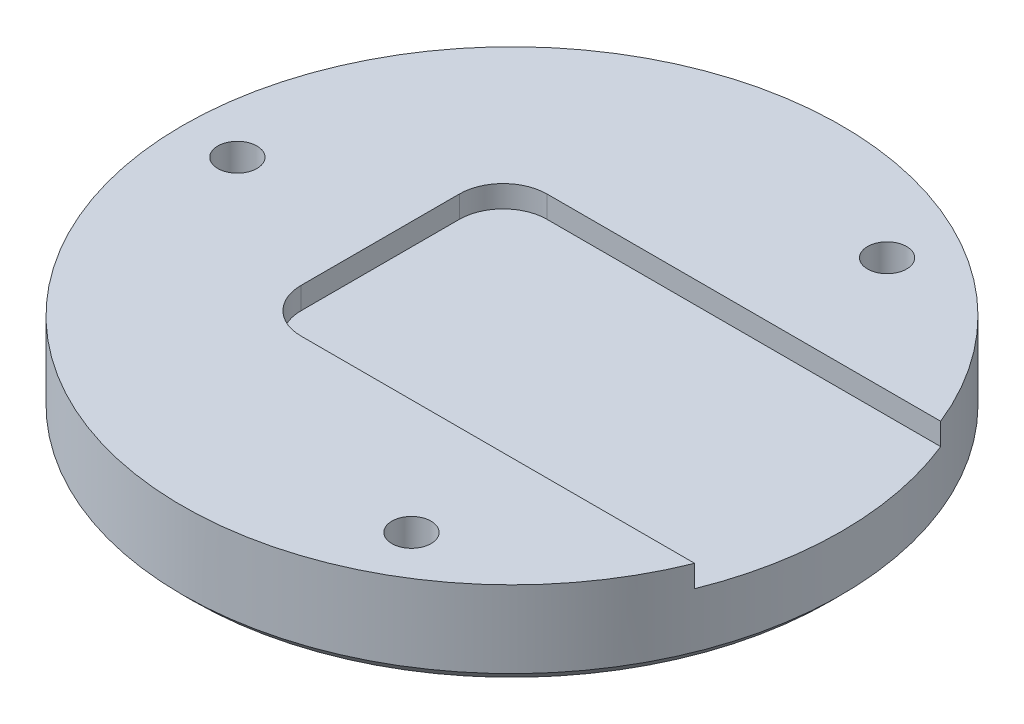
SolidWorks part; units mm, degrees
ref_plane "Front" through (0, 0, 0) normal (0, 0, 1) x (1, 0, 0)
ref_plane "Top" through (0, 0, 0) normal (0, 1, 0) x (1, 0, 0)
ref_plane "Right" through (0, 0, 0) normal (1, 0, 0) x (0, 0, -1)
sketch "Sketch1" plane through (48.1759, -74.1551, 64.1678) normal (0, 1, 0) x (0.9893, 0, -0.1461)
  circle A0 centre (0, 0) radius 19.05
  circle A2 centre (-0.0048, -0.0439) radius 19.05 construction
extrude "Boss-Extrude1" add sketch "Sketch1" along normal blind 5.08 from offset 10.16
sketch "Sketch2" plane through (0, 0, 0) normal (0, 1, 0) x (1, 0, 0)
  line L0 (48.1759, -64.1678) -> (67.2259, -64.1678) construction
  line L1 (43.0959, -57.0558) -> (65.8486, -57.0558)
  line L2 (43.0959, -71.2798) -> (65.8486, -71.2798)
  line L6 (40.5559, -59.5958) -> (40.5559, -68.7398)
  arc A1 (43.0959, -71.2798) -> (40.5559, -68.7398) centre (43.0959, -68.7398) cw
  arc A2 (65.8486, -57.0558) -> (65.8486, -71.2798) centre (48.1759, -64.1678) cw
  circle A3 centre (48.1759, -64.1678) radius 19.05 construction
  arc A4 (43.0959, -57.0558) -> (40.5559, -59.5958) centre (43.0959, -59.5958) ccw
  point P13 (67.2259, -64.1678)
  dimension "D1" = 2.54
  dimension "D2" = 14.224
  dimension "D4" = 7.62
extrude "Cut-Extrude1" cut sketch "Sketch2" against normal blind 1.27 from surface at -79.2351
hole_wizard "#4-40 Tapped Hole1" positions "Sketch3" profile "Sketch4" tap size "#4-40" standard "ANSI Inch"
sketch "Sketch3" plane through (0, -79.2351, 0) normal (0, 1, 0) x (1, 0, 0)
  circle A0 centre (48.1759, -64.1678) radius 15.875 construction
  circle A1 centre (48.1759, -64.1678) radius 19.05 construction
  point P0 (32.3009, -64.1678)
  dimension "D1" = 31.75
sketch "Sketch4" plane through (32.3009, -79.2351, 64.1678) normal (1, 0, 0) x (0, 0, 1)
  line L0 (0, 0) -> (0, 5.08)
  line L1 (0, 5.08) -> (1.1303, 5.08)
  line L2 (1.1303, 5.08) -> (1.1303, 0)
  line L5 (1.1303, 0) -> (0, 0)
  line L11 (0, -6.35) -> (0, 107.95) construction
  dimension "Thru Tap Drill Dia." = 2.2606
  dimension "Thru Tap Drill Depth" = 5.08
pattern_circular "CirPattern1" count 3 over 360 about axis through (48.1759, 0, 64.1678) along (0, 1, 0) of "#4-40 Tapped Hole1"
chamfer "Chamfer1" distance 0.635 angle 45 1 edges at (48.1759, -84.3151, 83.2178)
